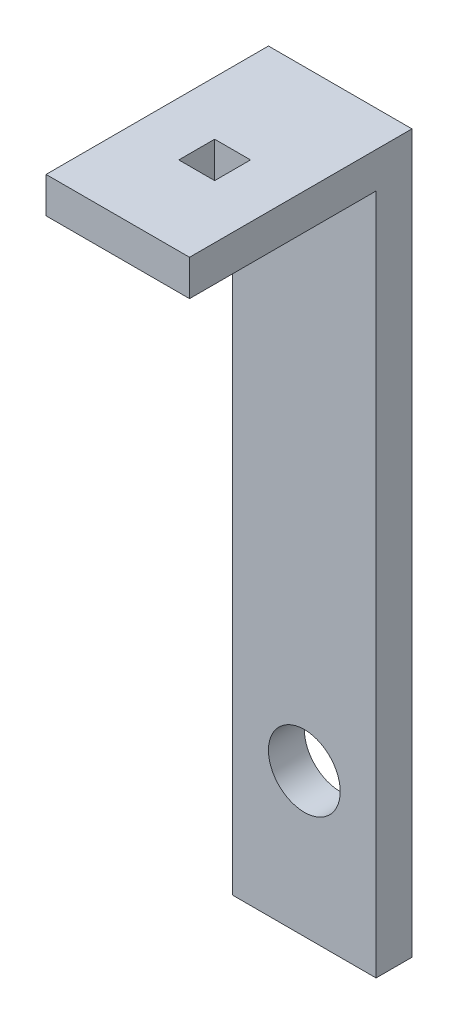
SolidWorks part; units mm, degrees
ref_plane "Front" through (0, 0, 0) normal (0, 0, 1) x (1, 0, 0)
ref_plane "Top" through (0, 0, 0) normal (0, 1, 0) x (1, 0, 0)
ref_plane "Right" through (0, 0, 0) normal (1, 0, 0) x (0, 0, -1)
ref_plane "Plane1" through (12.8097, 0, 0) normal (1, 0, 0) x (0, 0, -1)
sketch "Sketch2" plane through (0, 0, 0) normal (1, 0, 0) x (0, 0, -1)
  line L0 (0, 0) -> (-31, 0)
  line L1 (0, 0) -> (0, -100)
  line L2 (0, -100) -> (-5, -100)
  line L3 (-5, -100) -> (-5, -5)
  line L4 (-31, 0) -> (-31, -5)
  line L5 (-31, -5) -> (-5, -5)
  dimension "D1" = 5
  dimension "D6" = 100
extrude "Boss-Extrude1" add sketch "Sketch2" along normal blind 20 separate body
sketch "Sketch3" plane through (0, 8.3082, 5) normal (0, 0, -1) x (1, 0, 0)
  line L1 (20, 108.3082) -> (0, 108.3082) construction
  line L2 (20, 108.3082) -> (20, 8.3082) construction
  circle A0 centre (10, 88.3082) radius 5
  dimension "D2" = 10
  dimension "D1" = 20
  dimension "D3" = 10
extrude "Cut-Extrude1" cut sketch "Sketch3" along normal blind 20
sketch "Sketch4" plane through (0, -5, 24.1608) normal (0, 1, 0) x (1, 0, 0)
  line L0 (20, -6.8392) -> (0, -6.8392) construction
  line L1 (7.5, 9.1608) -> (12.5, 9.1608)
  line L2 (7.5, 9.1608) -> (7.5, 4.1608)
  line L3 (7.5, 4.1608) -> (12.5, 4.1608)
  line L4 (12.5, 9.1608) -> (12.5, 4.1608)
  line L5 (20, 24.1608) -> (20, -6.8392) construction
  line L6 (7.5, 9.1608) -> (12.5, 4.1608) construction
  point P8 (10, 6.6608)
  dimension "D1" = 5
  dimension "D2" = 7.5
  dimension "D3" = 11
extrude "Cut-Extrude2" cut sketch "Sketch4" along normal blind 15
